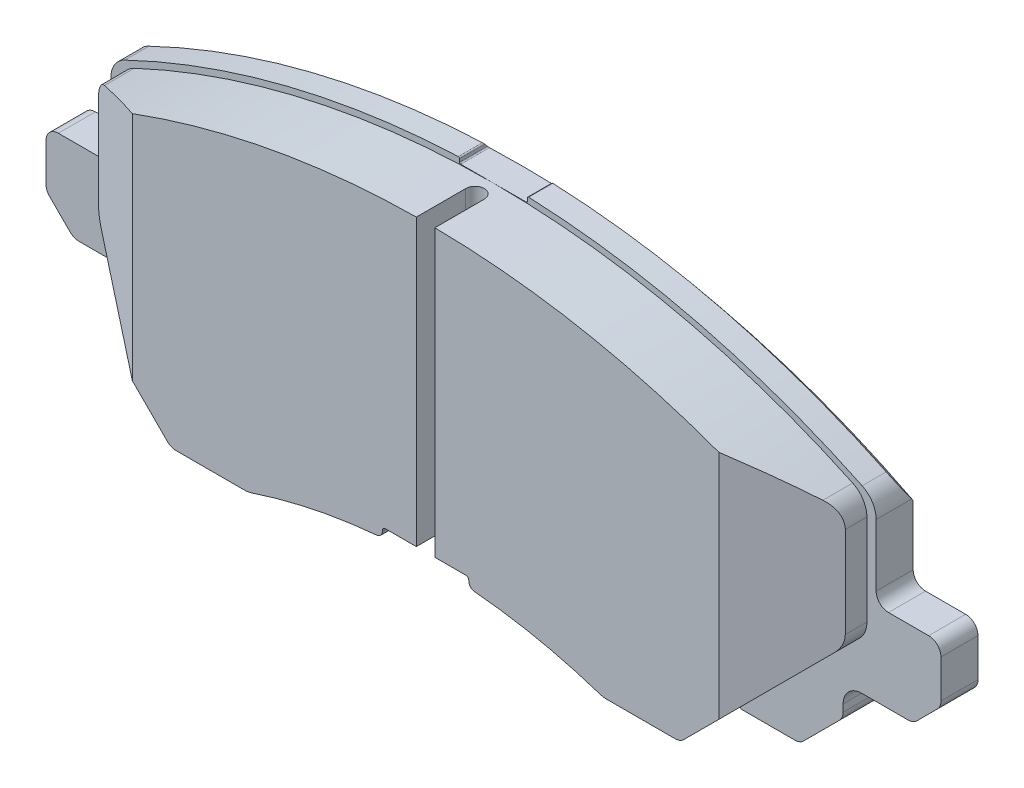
SolidWorks part; units mm, degrees
ref_plane "Front Plane" through (0, 0, 0) normal (0, 0, 1) x (1, 0, 0)
ref_plane "Top Plane" through (0, 0, 0) normal (0, 1, 0) x (1, 0, 0)
ref_plane "Right Plane" through (0, 0, 0) normal (1, 0, 0) x (0, 0, -1)
sketch "Sketch1" plane through (0, 0, 0) normal (0, 0, 1) x (1, 0, 0)
  line L0 (-28.5, 83.2571) -> (-30, 83.2571)
  line L1 (0, 0) -> (0, 179.7829) construction
  line L2 (-62, 120.7974) -> (-62, 110.7571)
  line L3 (-59.65, 95.2571) -> (-67.1716, 95.2571)
  line L4 (30, 84.4571) -> (30, 83.2571)
  line L5 (-70.5, 108.7571) -> (-64, 108.7571)
  line L6 (-72.5, 106.7571) -> (-72.5, 100.5856)
  line L7 (-56.65, 92.2571) -> (-56.65, 91.0856)
  line L8 (-68.5858, 95.8429) -> (-71.9142, 99.1713)
  line L9 (-50.2358, 83.8429) -> (-56.0642, 89.6713)
  line L10 (-40, 83.2571) -> (-48.8216, 83.2571)
  line L11 (-6.5, 89.25) -> (6.5, 89.25)
  line L12 (-5.5, 137.8904) -> (-5.5, 137)
  line L13 (-5.5, 137) -> (5.5, 137)
  line L14 (5.5, 137.8904) -> (5.5, 137)
  line L15 (-6.5, 89.25) -> (-6.5, 87.7596)
  line L16 (-40, 84.4571) -> (-30, 84.4571)
  line L17 (6.5, 89.25) -> (6.5, 87.7596)
  line L18 (-40, 84.4571) -> (-40, 83.2571)
  line L19 (40, 84.4571) -> (40, 83.2571)
  line L20 (-30, 84.4571) -> (-30, 83.2571)
  line L21 (40, 84.4571) -> (30, 84.4571)
  line L22 (40, 83.2571) -> (48.8216, 83.2571)
  line L23 (50.2358, 83.8429) -> (56.0642, 89.6713)
  line L24 (68.5858, 95.8429) -> (71.9142, 99.1713)
  line L25 (56.65, 92.2571) -> (56.65, 91.0856)
  line L26 (72.5, 106.7571) -> (72.5, 100.5856)
  line L27 (70.5, 108.7571) -> (64, 108.7571)
  line L28 (59.65, 95.2571) -> (67.1716, 95.2571)
  line L29 (62, 120.7974) -> (62, 110.7571)
  line L30 (28.5, 83.2571) -> (30, 83.2571)
  arc A0 (59.7313, 124.4032) -> (5.5, 137.8904) centre (0, 0) ccw
  arc A1 (28.5, 83.2571) -> (6.5, 87.7596) centre (0, 0) ccw
  arc A2 (-5.5, 137.8904) -> (-59.7313, 124.4032) centre (0, 0) ccw
  arc A3 (-6.5, 87.7596) -> (-28.5, 83.2571) centre (0, 0) ccw
  arc A4 (-62, 120.7974) -> (-59.7313, 124.4032) centre (-58, 120.7974) cw
  arc A5 (62, 120.7974) -> (59.7313, 124.4032) centre (58, 120.7974) ccw
  arc A6 (64, 108.7571) -> (62, 110.7571) centre (64, 110.7571) cw
  arc A7 (56.65, 92.2571) -> (59.65, 95.2571) centre (59.65, 92.2571) cw
  arc A8 (56.0642, 89.6713) -> (56.65, 91.0856) centre (54.65, 91.0856) ccw
  arc A9 (48.8216, 83.2571) -> (50.2358, 83.8429) centre (48.8216, 85.2571) ccw
  arc A10 (72.5, 106.7571) -> (70.5, 108.7571) centre (70.5, 106.7571) ccw
  arc A11 (71.9142, 99.1713) -> (72.5, 100.5856) centre (70.5, 100.5856) ccw
  arc A12 (68.5858, 95.8429) -> (67.1716, 95.2571) centre (67.1716, 97.2571) cw
  arc A13 (-62, 110.7571) -> (-64, 108.7571) centre (-64, 110.7571) cw
  arc A14 (-59.65, 95.2571) -> (-56.65, 92.2571) centre (-59.65, 92.2571) cw
  arc A15 (-72.5, 106.7571) -> (-70.5, 108.7571) centre (-70.5, 106.7571) cw
  arc A16 (-71.9142, 99.1713) -> (-72.5, 100.5856) centre (-70.5, 100.5856) cw
  arc A17 (-68.5858, 95.8429) -> (-67.1716, 95.2571) centre (-67.1716, 97.2571) ccw
  arc A18 (-56.0642, 89.6713) -> (-56.65, 91.0856) centre (-54.65, 91.0856) cw
  arc A19 (-50.2358, 83.8429) -> (-48.8216, 83.2571) centre (-48.8216, 85.2571) ccw
  point P9 (-72.5, 95.2571)
  point P11 (-56.65, 83.2571)
  point P39 (56.65, 83.2571)
  point P40 (72.5, 95.2571)
  point P43 (-62, 123.2883)
  point P46 (62, 123.2883)
  point P49 (62, 108.7571)
  point P52 (56.65, 95.2571)
  point P55 (56.65, 90.2571)
  point P58 (49.65, 83.2571)
  point P61 (72.5, 108.7571)
  point P64 (72.5, 99.7571)
  point P67 (68, 95.2571)
  point P70 (-62, 108.7571)
  point P73 (-56.65, 95.2571)
  point P76 (-72.5, 108.7571)
  point P79 (-72.5, 99.7571)
  point P82 (-68, 95.2571)
  point P85 (-56.65, 90.2571)
  point P88 (-49.65, 83.2571)
  dimension "D1" = 276
  dimension "D4" = 50
  dimension "D3" = 4
  dimension "D5" = 4
  dimension "D22" = 2
  dimension "D23" = 3
  dimension "D24" = 2
  dimension "D25" = 2
  dimension "D26" = 2
  dimension "D27" = 3
  dimension "D28" = 2
  dimension "D29" = 2
  dimension "D2" = 62
  dimension "D6" = 28.5
  dimension "D7" = 11
  dimension "D8" = 56.65
  dimension "D9" = 12
  dimension "D10" = 13.5
  dimension "D11" = 10.5
  dimension "D16" = 4.5
  dimension "D17" = 7
  dimension "D12" = 137
  dimension "D13" = 5.5
  dimension "D14" = 47.75
  dimension "D15" = 13
  dimension "D18" = 6.5
  dimension "D19" = 1.5
  dimension "D20" = 1.2
  dimension "D21" = 10
extrude "Extrude1" add sketch "Sketch1" along normal blind 6
sketch "Sketch2" plane through (0, 0, 6) normal (0, 0, 1) x (1, 0, 0)
  line L0 (40, 83.2571) -> (48.8216, 83.2571) construction
  line L1 (72.5, 100.5856) -> (72.5, 106.7571) construction
  line L2 (0, 0) -> (0, 182.2669) construction
  circle A0 centre (33.5, 108.2571) radius 8
  circle A1 centre (-33.5, 108.2571) radius 8
  dimension "D1" = 16
  dimension "D2" = 17
  dimension "D3" = 31
extrude "Cut-Extrude1" cut sketch "Sketch2" against normal blind 6
sketch "Sketch4" plane through (0, 0, 6) normal (0, 0, 1) x (1, 0, 0)
  line L0 (-6.5, 89.25) -> (6.5, 89.25) construction
  line L1 (-6.5, 90.75) -> (6.5, 90.75)
  line L2 (0, 0) -> (0, 190.474) construction
  line L3 (-7, 90.25) -> (-7, 90.1457)
  line L4 (60.5, 105.6635) -> (60.5, 120.4025)
  line L5 (-41.8363, 85.3429) -> (-59.3284, 102.8351)
  line L6 (-56.0642, 89.6713) -> (-50.2358, 83.8429) construction
  line L7 (-30, 83.2571) -> (-28.5, 83.2571) construction
  line L8 (29.401, 84.7571) -> (40.4221, 84.7571)
  line L9 (-29.401, 84.7571) -> (-40.4221, 84.7571)
  line L10 (-60.5, 105.6635) -> (-60.5, 120.4025)
  line L11 (41.8363, 85.3429) -> (59.3284, 102.8351)
  line L12 (7, 90.25) -> (7, 90.1457)
  arc A0 (-60.5, 105.6635) -> (-59.3284, 102.8351) centre (-56.5, 105.6635) ccw
  arc A1 (-58.1992, 124.0236) -> (-60.5, 120.4025) centre (-56.5, 120.4025) ccw
  arc A2 (58.1992, 124.0236) -> (-58.1992, 124.0236) centre (0, 0) ccw
  arc A3 (-6.5, 87.7596) -> (-28.5, 83.2571) centre (0, 0) ccw construction
  arc A4 (-7.9116, 89.1496) -> (-28.1432, 84.96) centre (0, 0) ccw
  arc A5 (-28.1432, 84.96) -> (-29.401, 84.7571) centre (-29.401, 88.7571) cw
  arc A6 (-40.4221, 84.7571) -> (-41.8363, 85.3429) centre (-40.4221, 86.7571) cw
  arc A7 (-7, 90.1457) -> (-7.9116, 89.1496) centre (-8, 90.1457) cw
  arc A8 (-6.5, 90.75) -> (-7, 90.25) centre (-6.5, 90.25) ccw
  arc A9 (6.5, 90.75) -> (7, 90.25) centre (6.5, 90.25) cw
  arc A10 (7, 90.1457) -> (7.9116, 89.1496) centre (8, 90.1457) ccw
  arc A11 (40.4221, 84.7571) -> (41.8363, 85.3429) centre (40.4221, 86.7571) ccw
  arc A12 (28.1432, 84.96) -> (29.401, 84.7571) centre (29.401, 88.7571) ccw
  arc A13 (7.9116, 89.1496) -> (28.1432, 84.96) centre (0, 0) cw
  arc A14 (58.1992, 124.0236) -> (60.5, 120.4025) centre (56.5, 120.4025) cw
  arc A15 (60.5, 105.6635) -> (59.3284, 102.8351) centre (56.5, 105.6635) cw
  point P51 (0, 90.75)
  dimension "D2" = 1.5
  dimension "D4" = 4
  dimension "D5" = 4
  dimension "D6" = 4
  dimension "D7" = 2
  dimension "D8" = 1
  dimension "D11" = 0.5
  dimension "D1" = 7
  dimension "D3" = 1.5
  dimension "D9" = 1.5
  dimension "D10" = 7
extrude "Extrude2" add sketch "Sketch4" along normal blind 11
sketch "Sketch6" plane through (0, 90.75, 0) normal (0, -1, 0) x (1, 0, 0)
  line L0 (-6.5, 0) -> (6.5, 0) construction
  line L1 (-1.5, 22.5998) -> (1.5, 22.5998)
  line L2 (-1.5, 22.5998) -> (-1.5, 9)
  line L3 (-6.5, 6) -> (6.5, 6) construction
  line L4 (1.5, 22.5998) -> (1.5, 9)
  arc A0 (-1.5, 9) -> (1.5, 9) centre (0, 9) ccw
  point P4 (0, 0)
  dimension "D1" = 3
  dimension "D2" = 1.5
  dimension "D3" = 3
extrude "Cut-Extrude2" cut sketch "Sketch6" against normal through all
sketch "Sketch7" plane through (0, 84.7571, 0) normal (0, -1, 0) x (1, 0, 0)
  line L0 (-60.5, 9.5) -> (-40.5228, 21.0338)
  line L1 (-40.4221, 17) -> (-29.401, 17) construction
  line L2 (-60.5, 9.5) -> (-60.5, 40.6853)
  line L4 (0, 59.4066) -> (0, -45.6033) construction
  line L5 (-60.5, 40.6853) -> (60.5, 40.6853)
  line L6 (60.5, 9.5) -> (60.5, 40.6853)
  line L7 (60.5, 9.5) -> (40.5228, 21.0338)
  line L8 (-40.5228, 21.0338) -> (40.5228, 21.0338)
  dimension "D1" = 30
  dimension "D2" = 3.5
extrude "Cut-Extrude3" cut sketch "Sketch7" against normal through all
sketch "Sketch8" plane through (0, 0, 6) normal (0, 0, -1) x (-1, 0, 0)
  line L0 (0, 0) -> (0, 168.408) construction
  circle A0 centre (-33.5, 108.2571) radius 8
  circle A1 centre (33.5, 108.2571) radius 8
extrude "Extrude3" add sketch "Sketch8" along normal blind 5.9
sketch "Sketch9" plane through (0, 0, 0) normal (0, 0, -1) x (-1, 0, 0)
  line L0 (-55.0945, 88.7017) -> (-51.2055, 84.8126)
  line L1 (-54.741, 91.8837) -> (-53.3268, 90.4694)
  line L2 (-49.4377, 95.7727) -> (-44.1344, 90.4694)
  line L3 (-46.786, 93.1211) -> (-46.786, 92.3062) construction
  line L4 (-51.3822, 88.5249) -> (-46.786, 93.1211) construction
  line L5 (-54.741, 91.8837) -> (-50.8519, 95.7727)
  line L6 (-49.7003, 96.0353) -> (-43.8718, 90.2069) construction
  line L7 (-54.2964, 91.4391) -> (-48.468, 85.6107) construction
  line L8 (-48.0235, 85.1661) -> (-44.1344, 89.0552)
  line L9 (-50.8519, 95.7727) -> (-49.4377, 95.7727)
  line L10 (-44.1344, 89.0552) -> (-44.1344, 90.4694)
  line L11 (-55.0945, 88.7017) -> (-53.3268, 90.4694)
  line L12 (-51.2055, 84.8126) -> (-49.4377, 86.5804)
  line L13 (-53.3268, 90.4694) -> (-49.4377, 94.3585) construction
  line L14 (-49.4377, 86.5804) -> (-45.5486, 90.4694) construction
  line L15 (-49.4377, 86.5804) -> (-48.0235, 85.1661)
  line L16 (-56.0642, 89.6713) -> (-50.2358, 83.8429) construction
  line L17 (0, 0) -> (0, 144.183) construction
  line L18 (51.3822, 88.5249) -> (46.786, 93.1211) construction
  line L19 (46.786, 93.1211) -> (46.786, 92.3062) construction
  line L20 (49.4377, 86.5804) -> (48.0235, 85.1661)
  line L21 (51.2055, 84.8126) -> (49.4377, 86.5804)
  line L22 (55.0945, 88.7017) -> (53.3268, 90.4694)
  line L23 (44.1344, 89.0552) -> (44.1344, 90.4694)
  line L24 (50.8519, 95.7727) -> (49.4377, 95.7727)
  line L25 (48.0235, 85.1661) -> (44.1344, 89.0552)
  line L26 (54.741, 91.8837) -> (50.8519, 95.7727)
  line L27 (49.4377, 95.7727) -> (44.1344, 90.4694)
  line L28 (54.741, 91.8837) -> (53.3268, 90.4694)
  line L29 (55.0945, 88.7017) -> (51.2055, 84.8126)
  point P17 (-50.1448, 96.4799)
  point P19 (-43.4273, 89.7623)
  point P43 (43.4273, 89.7623)
  point P44 (50.1448, 96.4799)
  dimension "D3" = 4.75
  dimension "D6" = 1
  dimension "D7" = 1
  dimension "D4" = 2
  dimension "D1" = 2.5
  dimension "D2" = 6.5
  dimension "D5" = 2
extrude "Cut-Extrude4" cut sketch "Sketch9" against normal blind 0.5
sketch "Sketch10"
extrude "Cut-Extrude5" cut sketch "Sketch10" against normal blind 0.1
chamfer "Chamfer1" distance 2.5 angle 40 1 edges at (33.3055, 133.9207, 0)
fillet "Fillet1" radius 0.2 16 edges at (-30, 84.4571, 3) (-30, 83.2571, 3) (-40, 83.2571, 3) (-40, 84.4571, 3) (30, 84.4571, 3) (30, 83.2571, 3) (40, 84.4571, 3) (40, 83.2571, 3) (-6.5, 89.25, 3) (-6.5, 87.7596, 3) (6.5, 89.25, 3) (6.5, 87.7596, 3) (-5.5, 137, 3.6756) (5.5, 137, 3.6756) (-5.5, 137.8904, 4.0489) (5.5, 137.8904, 4.0489)
fillet "Fillet2" radius 0.1 18 edges at (-44.1344, 89.7623, 0) (-46.0789, 87.1107, 0) (-48.7306, 85.8732, 0) (-50.3216, 85.6965, 0) (-54.2107, 89.5856, 0) (-54.0339, 91.1765, 0) (-52.7964, 93.8282, 0) (-50.1448, 95.7727, 0) (-46.786, 93.1211, 0) (54.0339, 91.1765, 0) (54.2107, 89.5856, 0) (50.3216, 85.6965, 0) (48.7306, 85.8732, 0) (46.0789, 87.1107, 0) (44.1344, 89.7623, 0) (46.786, 93.1211, 0) (50.1448, 95.7727, 0) (52.7964, 93.8282, 0)
